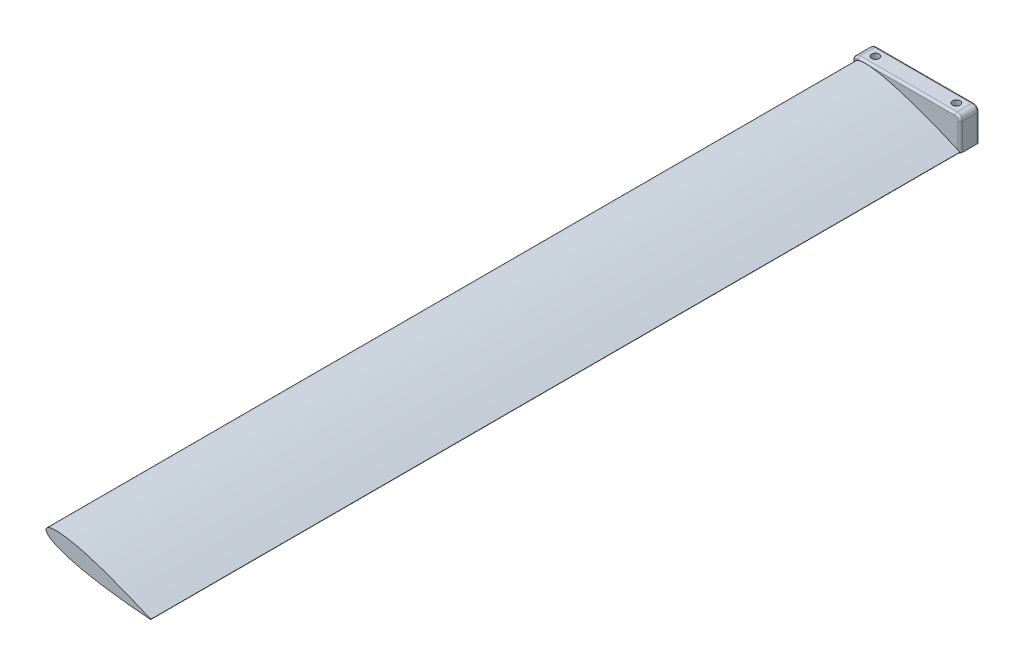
SolidWorks part; units mm, degrees
ref_plane "Front Plane" through (0, 0, 0) normal (0, 0, 1) x (1, 0, 0)
ref_plane "Top Plane" through (0, 0, 0) normal (0, 1, 0) x (1, 0, 0)
ref_plane "Right Plane" through (0, 0, 0) normal (1, 0, 0) x (0, 0, -1)
curve "Curve1"
sketch "Sketch11" plane through (0, 0, 0) normal (0, 0, 1) x (1, 0, 0)
  arc A0 (49.2716, -12.3675) -> (49.3104, -12.2118) centre (49.2131, -12.2702) ccw
  spline S0 degree 3 poles (1013.8948, 1736.315) (152.4583, -87.3855) (104.6437, -35.7578) (43.8001, -9.8303) (39.8446, -8.204) (35.0751, -6.333) (30.285, -4.5471) (25.4694, -2.863) (20.6201, -1.3105) (16.5369, -0.1715) (13.2378, 0.6034) (10.7401, 1.0967) (8.2109, 1.4781) (6.0721, 1.6624) (4.332, 1.6814) (2.987, 1.6007) (1.8199, 1.3867) (0.7219, 0.9924) (-0.2835, 0.0707) (0.1715, -1.2151) (0.9559, -2.0788) (1.8859, -2.8157) (3.0355, -3.5183) (4.5808, -4.3185) (6.5559, -5.1598) (8.9681, -6.0105) (11.405, -6.7476) (14.6817, -7.6122) (18.8217, -8.5235) (23.8322, -9.4293) (28.8748, -10.2031) (33.9427, -10.8751) (39.0322, -11.4622) (43.2883, -11.8832) (109.1829, -17.555) (175.6391, 5.5812) (80.071, -2009.0445) knots -1.802366 -1.802366 -1.802366 -1.802366 0.024684 0.04933 0.098522 0.147602 0.196578 0.24545 0.294219 0.342904 0.367241 0.391608 0.416059 0.440726 0.453243 0.466028 0.479473 0.486972 0.5 0.513028 0.520527 0.533972 0.546757 0.559274 0.583941 0.608392 0.632759 0.657096 0.705781 0.75455 0.803422 0.852398 0.901478 0.95067 0.975316 2.802387 2.802387 2.802387 2.802387 only from (49.3104, -12.2118) to (49.2716, -12.3675) construction
  spline S1 degree 3 poles (49.3104, -12.2118) (48.5244, -11.8657) (46.9536, -11.1741) (43.8001, -9.8303) (39.8446, -8.204) (35.0751, -6.333) (30.285, -4.5471) (25.4694, -2.863) (20.6201, -1.3105) (16.5369, -0.1715) (13.2378, 0.6034) (10.7401, 1.0967) (8.2109, 1.4781) (6.0721, 1.6624) (4.332, 1.6814) (2.987, 1.6007) (1.8199, 1.3867) (0.7219, 0.9924) (-0.2835, 0.0707) (0.1715, -1.2151) (0.9559, -2.0788) (1.8859, -2.8157) (3.0355, -3.5183) (4.5808, -4.3185) (6.5559, -5.1598) (8.9681, -6.0105) (11.405, -6.7476) (14.6817, -7.6122) (18.8217, -8.5235) (23.8322, -9.4293) (28.8748, -10.2031) (33.9427, -10.8751) (39.0322, -11.4622) (43.2883, -11.8832) (46.7035, -12.1772) (48.4151, -12.304) (49.2716, -12.3675) knots 0 0 0 0 0.024684 0.04933 0.098522 0.147602 0.196578 0.24545 0.294219 0.342904 0.367241 0.391608 0.416059 0.440726 0.453243 0.466028 0.479473 0.486972 0.5 0.513028 0.520527 0.533972 0.546757 0.559274 0.583941 0.608392 0.632759 0.657096 0.705781 0.75455 0.803422 0.852398 0.901478 0.95067 0.975316 1 1 1 1
sketch "Sketch2" plane through (0, 0, 0) normal (0, 0, 1) x (1, 0, 0)
  line L1 (-1.27, 2.54) -> (49.53, 2.54)
  line L2 (-1.27, 2.54) -> (-1.27, -12.7)
  line L3 (-1.27, -12.7) -> (49.53, -12.7)
  line L4 (49.53, 2.54) -> (49.53, -12.7)
  dimension "D1" = 15.24
  dimension "D2" = 50.8
  dimension "D3" = 1.27
  dimension "D4" = 2.54
extrude "Boss-Extrude2" add sketch "Sketch2" against normal blind 8.89 contours L1 L4 L3 L2
sketch "Sketch3" plane through (0, 2.54, 0) normal (0, 1, 0) x (1, 0, 0)
  line L1 (49.53, 8.89) -> (49.53, 0) construction
  line L4 (-1.27, 0) -> (49.53, 0) construction
  circle A0 centre (43.18, 4.445) radius 1.7907
  circle A1 centre (5.08, 4.445) radius 1.7907
  point P2 (49.53, 4.445)
  point P6 (24.13, 4.445)
  point P9 (24.13, 0)
  dimension "D2" = 3.5814
  dimension "D3" = 3.5814
  dimension "D1" = 19.05
  dimension "D4" = 19.05
extrude "Cut-Extrude1" cut sketch "Sketch3" against normal through all
sketch "Sketch6" plane through (0, 0, 0) normal (0, 0, 1) x (1, 0, 0)
  spline S0 degree 3 poles (-4.287, -1.4019) (2.6366, 4.1578) (14.9598, 1.4425) (29.79, 1.0254) (42.6289, -4.8069) (50.4798, -8.7244) (50.5734, -14.6499) (44.5319, -14.0074) (38.3759, -13.9584) (26.0616, -12.9549) (13.2969, -13.5102) (1.1878, -10.231) (-4.287, -1.4019) (2.6366, 4.1578) (14.9598, 1.4425) knots -0.194029 -0.120897 -0.042291 0 0.070504 0.265505 0.372281 0.442858 0.459946 0.501537 0.553693 0.63686 0.805971 0.879103 0.957709 1 1.070504 1.265505 1.372281 only from (1.6773, 2.7378) to (1.6773, 2.7378)
ref_plane "Plane2" [suppressed] through (0, 0, 12.7) normal (0, 0, 1) x (1, 0, 0)
sketch "Sketch7" [suppressed] plane through (0, 0, 12.7) normal (0, 0, 1) x (1, 0, 0)
  arc A0 (49.3104, -12.2118) -> (49.2716, -12.3675) centre (48.9108, -12.1948) cw
  spline S0 degree 3 poles (1013.8948, 1736.315) (152.4583, -87.3855) (104.6437, -35.7578) (43.8001, -9.8303) (39.8446, -8.204) (35.0751, -6.333) (30.285, -4.5471) (25.4694, -2.863) (20.6201, -1.3105) (16.5369, -0.1715) (13.2378, 0.6034) (10.7401, 1.0967) (8.2109, 1.4781) (6.0721, 1.6624) (4.332, 1.6814) (2.987, 1.6007) (1.8199, 1.3867) (0.7219, 0.9924) (-0.2835, 0.0707) (0.1715, -1.2151) (0.9559, -2.0788) (1.8859, -2.8157) (3.0355, -3.5183) (4.5808, -4.3185) (6.5559, -5.1598) (8.9681, -6.0105) (11.405, -6.7476) (14.6817, -7.6122) (18.8217, -8.5235) (23.8322, -9.4293) (28.8748, -10.2031) (33.9427, -10.8751) (39.0322, -11.4622) (43.2883, -11.8832) (109.1829, -17.555) (175.6391, 5.5812) (80.071, -2009.0445) knots -1.802366 -1.802366 -1.802366 -1.802366 0.024684 0.04933 0.098522 0.147602 0.196578 0.24545 0.294219 0.342904 0.367241 0.391608 0.416059 0.440726 0.453243 0.466028 0.479473 0.486972 0.5 0.513028 0.520527 0.533972 0.546757 0.559274 0.583941 0.608392 0.632759 0.657096 0.705781 0.75455 0.803422 0.852398 0.901478 0.95067 0.975316 2.802387 2.802387 2.802387 2.802387 only from (49.3104, -12.2118) to (49.2716, -12.3675) construction
  spline S1 degree 3 poles (49.3104, -12.2118) (48.5244, -11.8657) (46.9536, -11.1741) (43.8001, -9.8303) (39.8446, -8.204) (35.0751, -6.333) (30.285, -4.5471) (25.4694, -2.863) (20.6201, -1.3105) (16.5369, -0.1715) (13.2378, 0.6034) (10.7401, 1.0967) (8.2109, 1.4781) (6.0721, 1.6624) (4.332, 1.6814) (2.987, 1.6007) (1.8199, 1.3867) (0.7219, 0.9924) (-0.2835, 0.0707) (0.1715, -1.2151) (0.9559, -2.0788) (1.8859, -2.8157) (3.0355, -3.5183) (4.5808, -4.3185) (6.5559, -5.1598) (8.9681, -6.0105) (11.405, -6.7476) (14.6817, -7.6122) (18.8217, -8.5235) (23.8322, -9.4293) (28.8748, -10.2031) (33.9427, -10.8751) (39.0322, -11.4622) (43.2883, -11.8832) (46.7035, -12.1772) (48.4151, -12.304) (49.2716, -12.3675) knots 0 0 0 0 0.024684 0.04933 0.098522 0.147602 0.196578 0.24545 0.294219 0.342904 0.367241 0.391608 0.416059 0.440726 0.453243 0.466028 0.479473 0.486972 0.5 0.513028 0.520527 0.533972 0.546757 0.559274 0.583941 0.608392 0.632759 0.657096 0.705781 0.75455 0.803422 0.852398 0.901478 0.95067 0.975316 1 1 1 1
loft "Loft2" [suppressed] add profiles "Sketch6", "Sketch7"
ref_plane "Plane3" through (0, 0, 381) normal (0, 0, 1) x (1, 0, 0)
sketch "Sketch8" plane through (0, 0, 381) normal (0, 0, 1) x (1, 0, 0)
  arc A0 (49.3068, -12.2189) -> (49.268, -12.3746) centre (48.9072, -12.2019) cw
  spline S0 degree 3 poles (49.3068, -12.2189) (48.5208, -11.8728) (46.95, -11.1812) (43.7965, -9.8374) (39.841, -8.2111) (35.0715, -6.3401) (30.2813, -4.5542) (25.4657, -2.8701) (20.6165, -1.3176) (16.5333, -0.1786) (13.2342, 0.5963) (10.7365, 1.0896) (8.2073, 1.471) (6.0684, 1.6553) (4.3283, 1.6743) (2.9834, 1.5936) (1.8163, 1.3796) (0.7182, 0.9853) (-0.2871, 0.0636) (0.1679, -1.2222) (0.9523, -2.0859) (1.8823, -2.8228) (3.0319, -3.5254) (4.5772, -4.3256) (6.5523, -5.1669) (8.9644, -6.0176) (11.4014, -6.7547) (14.6781, -7.6193) (18.8181, -8.5306) (23.8286, -9.4364) (28.8712, -10.2102) (33.939, -10.8822) (39.0286, -11.4693) (43.2846, -11.8903) (46.6999, -12.1843) (48.4115, -12.3111) (49.268, -12.3746) knots 0 0 0 0 0.024684 0.04933 0.098522 0.147602 0.196578 0.24545 0.294219 0.342904 0.367241 0.391608 0.416059 0.440726 0.453243 0.466028 0.479473 0.486972 0.5 0.513028 0.520527 0.533972 0.546757 0.559274 0.583941 0.608392 0.632759 0.657096 0.705781 0.75455 0.803422 0.852398 0.901478 0.95067 0.975316 1 1 1 1
ref_plane "Plane4" through (0, 0, 25.4) normal (0, 0, 1) x (1, 0, 0)
loft "Loft12" add profiles "Sketch8", "Sketch11"
fillet "Fillet1" radius 2.54 2 edges at (49.53, 2.54, -4.445) (-1.27, 2.54, -4.445)
fillet "Fillet2" radius 1.016 10 edges at (-1.27, -6.35, -8.89) (-0.5261, 1.7961, -8.89) (24.13, 2.54, -8.89) (48.7861, 1.7961, -8.89) (-1.27, -6.35, 0) (-0.5261, 1.7961, 0) (24.13, 2.54, 0) (48.7861, 1.7961, 0) (49.53, -6.35, -8.89) (49.53, -6.35, 0)
sketch "Sketch10" plane through (0, 0, -8.89) normal (0, 0, -1) x (-1, 0, 0)
  line L0 (0, 0) -> (-27.3249, -6.8129) construction
  line L1 (0, 0) -> (-4.9981, 0) construction
  circle A0 centre (-11.0905, -2.7652) radius 2
  circle A1 centre (-19.7164, -4.9159) radius 2
  circle A2 centre (-28.3423, -7.0665) radius 2
  dimension "D1" = 4
  dimension "D2" = 14
  dimension "D3" = 8.89
  dimension "D4" = 8.89
  dimension "D5" = 11.43
extrude "Cut-Extrude2" cut sketch "Sketch10" along direction (0, 0, 1) on the side against the normal blind 40
